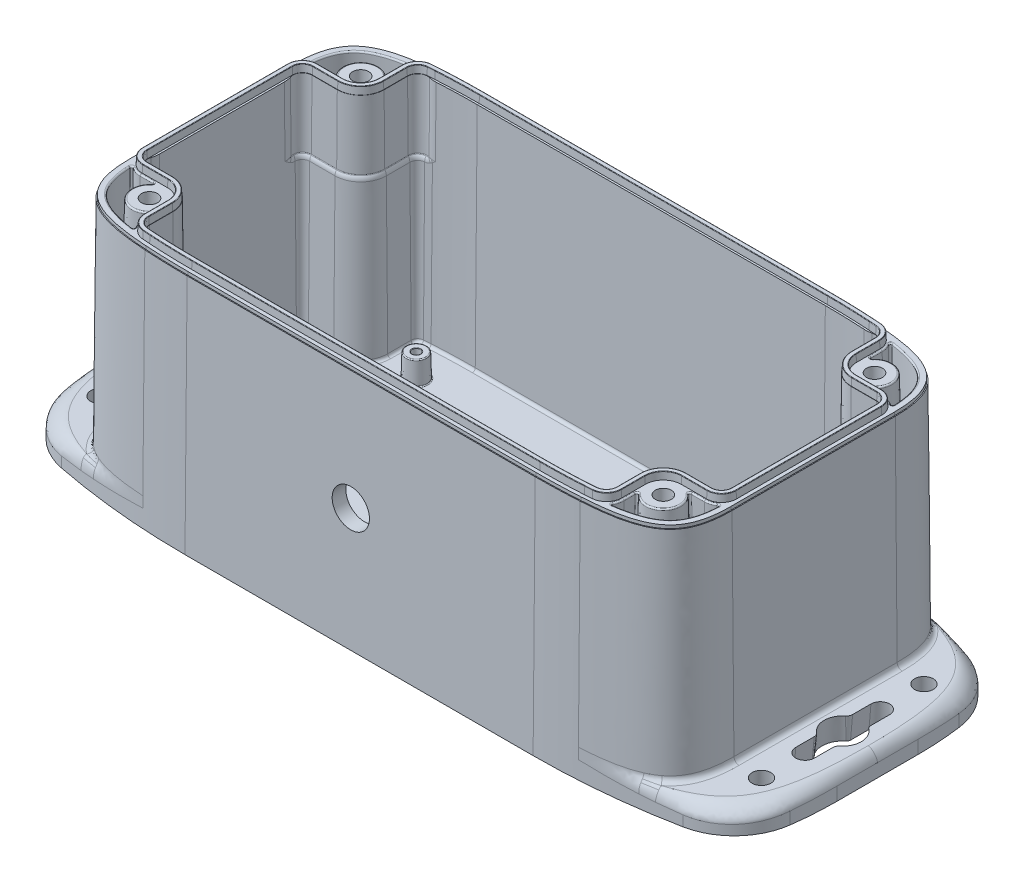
SolidWorks part; units mm, degrees
other "Face14[1]"
ref_plane "Front Plane" through (0, 0, 0) normal (0, 0, 1) x (1, 0, 0)
ref_plane "Top Plane" through (0, 0, 0) normal (0, 1, 0) x (1, 0, 0)
ref_plane "Right Plane" through (0, 0, 0) normal (1, 0, 0) x (0, 0, -1)
imported_body "Imported1"
sketch "Sketch1" plane through (0, 0.3652, 41.8459) normal (0, 0.0087, 1) x (1, 0, 0)
  line L0 (-99.9813, 3.4828) -> (-100.0125, -0.097) construction
  line L1 (-47.625, -0.3652) -> (47.625, -0.3652) construction
  circle A0 centre (-2.5526, 33.0481) radius 5.1
  point P4 (-99.9969, 1.6929)
  point P5 (0, 0)
  dimension "D3" = 10.2
  dimension "D1" = 97.4442
  dimension "D2" = 33.4133
extrude "Cut-Extrude1" cut sketch "Sketch1" against normal blind 10
